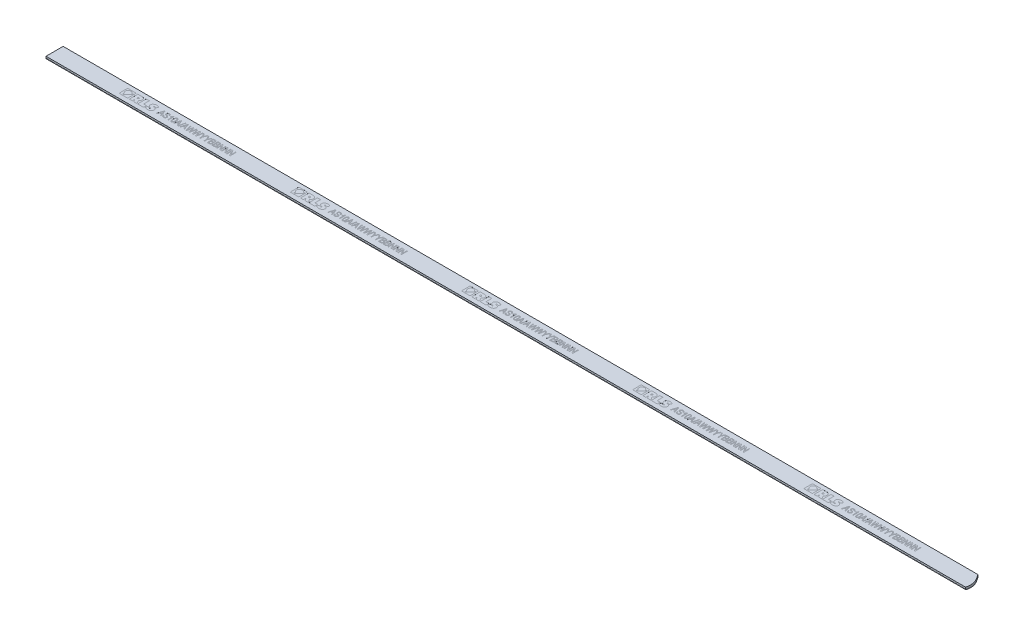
SolidWorks part; units mm, degrees
ref_plane "Front Plane" through (0, 0, 0) normal (0, 0, 1) x (1, 0, 0)
ref_plane "Top Plane" through (0, 0, 0) normal (0, 1, 0) x (1, 0, 0)
ref_plane "Right Plane" through (0, 0, 0) normal (1, 0, 0) x (0, 0, -1)
imported_body "Carrier-1-solid1"
imported_body "Magnetic scale^AS10_magnetic_scale-1-solid1"
sketch "Sketch1"
sketch_block_instance "Block-RLS_logo_for_rings-1"
sketch_block "Block-RLS_logo_for_rings" parameters "D1"=11.927
extrude "Cut-Extrude1" cut sketch "Sketch1" against normal blind 0.01
sketch "Sketch2" plane through (0, 9.3185, 0) normal (0, 1, 0) x (1, 0, 0)
  text T0 "AS10A/AWWYYBBNNN"
extrude "Cut-Extrude2" cut sketch "Sketch2" against normal blind 0.001
pattern_linear "LPattern1" count 5 spacing 100 along (1, 0, 0) of "Cut-Extrude1", "Cut-Extrude2"
sketch "Sketch3" plane through (-435.2728, 0, 0) normal (-1, 0, 0) x (0, 0, 1)
  line L0 (-44.7052, 8.1185) -> (-44.7052, 8.2185) construction
  line L1 (-44.2052, 8.0175) -> (-35.2052, 8.0175)
  line L2 (-44.2052, 8.0175) -> (-44.2052, 7.8885)
  line L3 (-44.2052, 7.8885) -> (-35.2052, 7.8885)
  line L4 (-35.2052, 8.0175) -> (-35.2052, 7.8885)
  line L5 (-34.7052, 8.2185) -> (-34.7052, 8.1185) construction
  line L6 (-34.8052, 8.0185) -> (-44.6052, 8.0185) construction
  line L7 (-44.7052, 9.3185) -> (-34.7052, 9.3185) construction
  point P4 (-44.2052, 7.953)
  dimension "D1" = 0.5
  dimension "D2" = 0.5
  dimension "D3" = 0.001
  dimension "D4" = 1.43
extrude "Boss-Extrude1" add sketch "Sketch3" against normal up to surface (1000 mm away) separate body
sketch "Sketch4" plane through (0, 9.3185, 0) normal (0, 1, 0) x (1, 0, 0)
  spline S0 degree 3 poles (249.6933, 66.5143) (137.4247, 103.0021) (90.4383, 52.291) (105.7984, 38.919) (69.5152, -16.269) (349.4795, -21.1864) (494.4397, -82.4419) (576.3115, 27.6656) (577.4783, 101.0037) (479.8283, 59.2032) (376.7753, 74.1684) (249.6933, 66.5143) (137.4247, 103.0021) (90.4383, 52.291) knots -0.356571 -0.283744 -0.119763 0 0.020066 0.03192 0.045484 0.174321 0.488027 0.515305 0.561117 0.643429 0.716256 0.880237 1 1.020066 1.03192 1.045484 only from (106.7141, 68.3626) to (106.7141, 68.3626)
extrude "Cut-Extrude3" cut sketch "Sketch4" against normal blind 11
